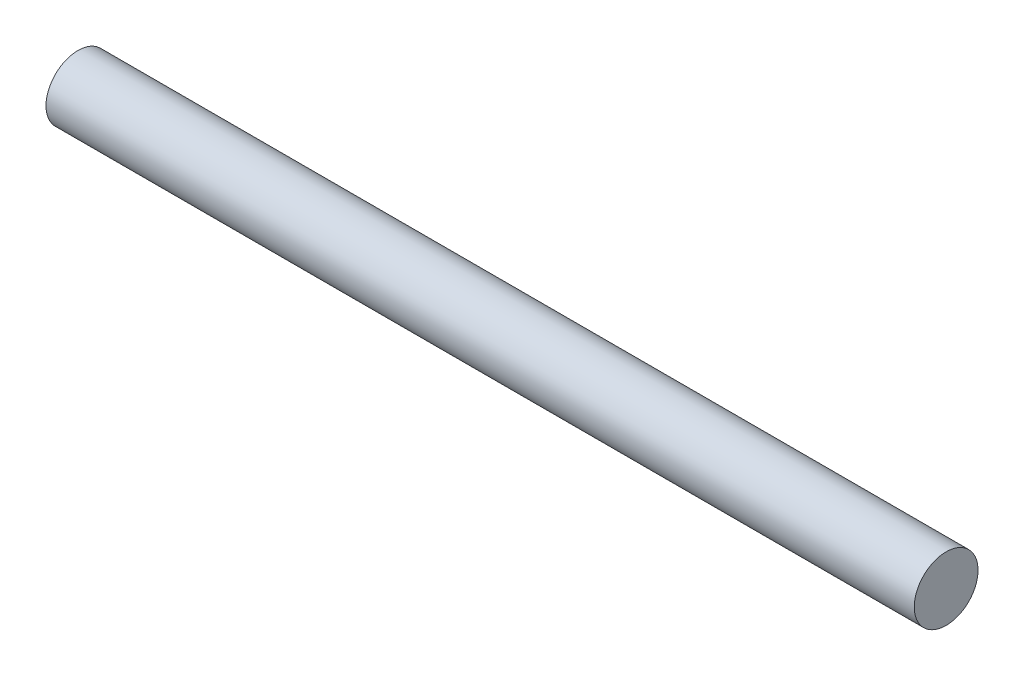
SolidWorks part; units mm, degrees
ref_plane "Front Plane" through (0, 0, 0) normal (0, 0, 1) x (1, 0, 0)
ref_plane "Top Plane" through (0, 0, 0) normal (0, 1, 0) x (1, 0, 0)
ref_plane "Right Plane" through (0, 0, 0) normal (1, 0, 0) x (0, 0, -1)
sketch "Sketch1" plane through (0, 0, 0) normal (1, 0, 0) x (0, 0, -1)
  circle A0 centre (0, 0) radius 1.4
  dimension "D1" = 2.8
extrude "Boss-Extrude1" add sketch "Sketch1" along normal blind 38.1
